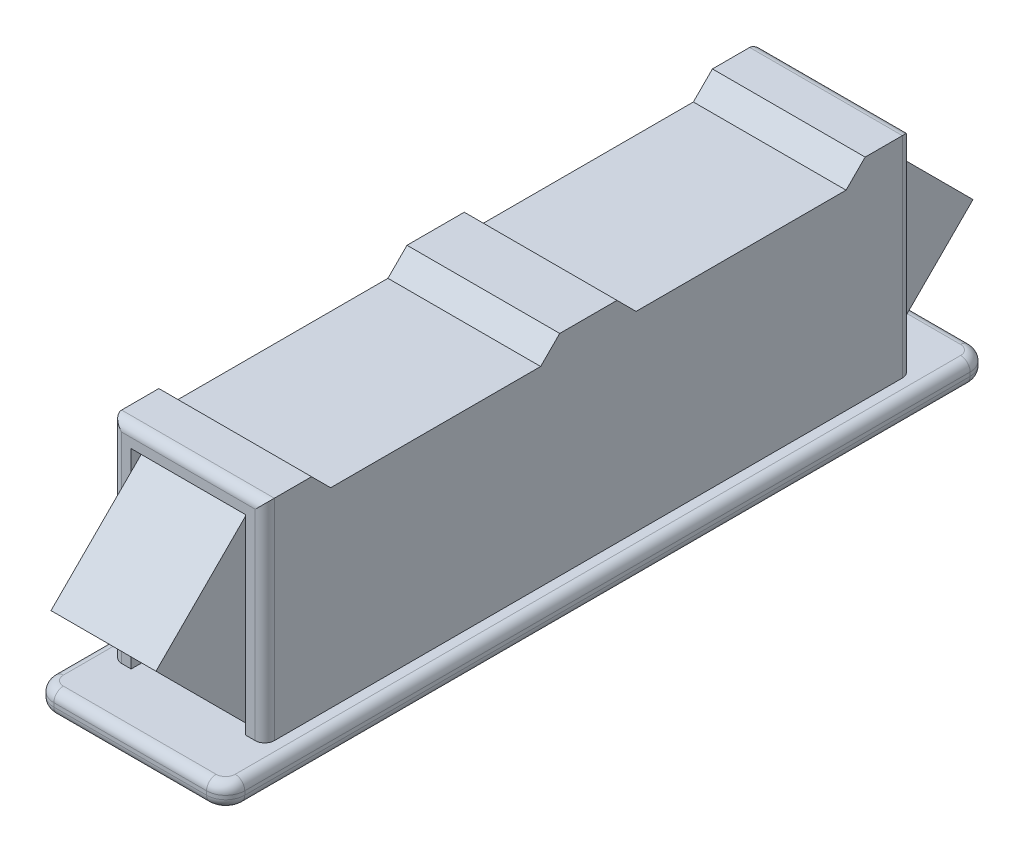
SolidWorks part; units mm, degrees
ref_plane "Front Plane" through (0, 0, 0) normal (0, 0, 1) x (1, 0, 0)
ref_plane "Top Plane" through (0, 0, 0) normal (0, 1, 0) x (1, 0, 0)
ref_plane "Right Plane" through (0, 0, 0) normal (1, 0, 0) x (0, 0, -1)
sketch "Sketch1" plane through (0, 0, 0) normal (0, 1, 0) x (1, 0, 0)
  line L1 (5, -20) -> (-5, -20)
  line L2 (5, -20) -> (5, 20)
  line L3 (5, 20) -> (-5, 20)
  line L4 (-5, -20) -> (-5, 20)
  line L5 (5, -20) -> (-5, 20) construction
  line L6 (5, 20) -> (-5, -20) construction
  point P0 (0, 0)
  dimension "D1" = 40
  dimension "D2" = 10
extrude "Boss-Extrude1" add sketch "Sketch1" against normal blind 1.2
sketch "Sketch2" plane through (0, -1.2, 0) normal (0, -1, 0) x (1, 0, 0)
  line L1 (4, 16.95) -> (-4, 16.95)
  line L2 (4, 16.95) -> (4, -16.95)
  line L3 (4, -16.95) -> (-4, -16.95)
  line L4 (-4, 16.95) -> (-4, -16.95)
  line L5 (4, 16.95) -> (-4, -16.95) construction
  line L6 (4, -16.95) -> (-4, 16.95) construction
  point P0 (0, 0)
  dimension "D1" = 8
  dimension "D2" = 33.9
extrude "Boss-Extrude2" add sketch "Sketch2" against normal blind 12.2
sketch "Sketch4" plane through (0, 0, 0) normal (0, 1, 0) x (1, 0, 0)
  line L0 (-8.6721, 0) -> (10.9166, 0) construction
sketch "Sketch6" plane through (0, -1.2, 0) normal (0, -1, 0) x (1, 0, 0)
  line L0 (0, -33.7192) -> (0, 34.4333) construction
sketch "Sketch7" plane through (0, -1.2, 0) normal (0, -1, 0) x (1, 0, 0)
  line L0 (0, -33.7192) -> (0, 34.4333) construction
  line L1 (-3.25, 1.5) -> (-1.75, 1.5)
  line L2 (-3.25, 1.5) -> (-3.25, 10.8)
  line L3 (-3.25, 10.8) -> (-1.75, 10.8)
  line L4 (-1.75, 1.5) -> (-1.75, 10.8)
  line L5 (-3.25, 1.5) -> (-1.75, 10.8) construction
  line L6 (-3.25, 10.8) -> (-1.75, 1.5) construction
  point P0 (-2.5, 6.15)
  point P5 (-2.5, 10.8)
  dimension "D1" = 1.5
  dimension "D2" = 9.3
  dimension "D3" = 2.5
  dimension "D4" = 1.5
extrude "Cut-Extrude1" cut sketch "Sketch7" against normal blind 0.5
mirror "Mirror1" about plane through (0, 0, 0) normal (1, 0, 0) of "Cut-Extrude1"
mirror "Mirror2" about plane through (0, 0, 0) normal (0, 0, 1) of "Mirror1", "Cut-Extrude1"
sketch "Sketch8" plane through (0, 0, 16.95) normal (0, 0, 1) x (1, 0, 0)
  line L0 (4, 11) -> (4, 0) construction
  line L1 (3, 0) -> (-3, 0)
  line L2 (3, 0) -> (3, 10)
  line L3 (3, 10) -> (-3, 10)
  line L4 (-3, 0) -> (-3, 10)
  line L5 (3, 0) -> (-3, 10) construction
  line L6 (3, 10) -> (-3, 0) construction
  line L7 (-4, 0) -> (4, 0) construction
  point P0 (0, 5)
  dimension "D1" = 10
  dimension "D2" = 6
  dimension "D3" = 4
extrude "Cut-Extrude2" cut sketch "Sketch8" against normal blind 1.5
mirror "Mirror3" about plane through (0, 0, 0) normal (0, 0, 1) of "Cut-Extrude2"
fillet "Fillet1" radius 1 4 edges at (-5, -0.6, -20) (5, -0.6, -20) (-5, -0.6, 20) (5, -0.6, 20)
fillet "Fillet2" radius 0.5 22 edges at (-4.7071, 0, 19.7071) (-5, 0, 0) (-4.7071, 0, -19.7071) (0, 0, -20) (4.7071, 0, -19.7071) (5, 0, 0) (4.7071, 0, 19.7071) (0, 0, 20) (4.7071, -1.2, 19.7071) (0, -1.2, 20) (-4.7071, -1.2, 19.7071) (-5, -1.2, 0) (-4.7071, -1.2, -19.7071) (0, -1.2, -20) (4.7071, -1.2, -19.7071) (-4, 5.5, -16.95) (0, 11, -16.95) (4, 5.5, -16.95) (-4, 5.5, 16.95) (0, 11, 16.95) (4, 5.5, 16.95) (5, -1.2, 0)
sketch "Sketch9" plane through (0, -0.7, 0) normal (0, -1, 0) x (1, 0, 0)
  line L0 (-1.75, 10.8) -> (-3.25, 10.8) construction
  line L1 (-1.75, 1.35) -> (-3.25, 1.35)
  line L2 (-1.75, 1.35) -> (-1.75, 10.8)
  line L3 (-1.75, 10.8) -> (-3.25, 10.8)
  line L4 (-3.25, 1.35) -> (-3.25, 10.8)
  line L5 (-1.75, 1.35) -> (-3.25, 10.8) construction
  line L6 (-1.75, 10.8) -> (-3.25, 1.35) construction
  line L7 (-1.75, 1.5) -> (-1.75, 10.8) construction
  line L8 (-4, 19.5) -> (4, 19.5) construction
  point P0 (-2.5, 6.075)
  dimension "D1" = 9.45
  dimension "D2" = 1.5
extrude "Boss-Extrude3" add sketch "Sketch9" along normal blind 1.8
fillet "Fillet3" radius 1 2 edges at (-2.5, -2.5, 1.35) (-2.5, -2.5, 10.8)
fillet "Fillet4" radius 0.2 10 edges at (-1.75, -1.35, 1.35) (-1.75, -2.2071, 1.6429) (-1.75, -1.35, 10.8) (-1.75, -2.2071, 10.5071) (-3.25, -1.35, 1.35) (-3.25, -1.35, 10.8) (-3.25, -2.2071, 10.5071) (-3.25, -2.5, 6.075) (-1.75, -2.5, 6.075) (-3.25, -2.2071, 1.6429)
mirror "Mirror4" about plane through (0, 0, 0) normal (1, 0, 0) of "Fillet4", "Fillet3", "Boss-Extrude3"
mirror "Mirror5" about plane through (0, 0, 0) normal (0, 0, 1) of "Mirror4", "Boss-Extrude3", "Fillet3", "Fillet4"
sketch "Sketch10" plane through (0, 0, 15.45) normal (0, 0, 1) x (1, 0, 0)
  line L1 (-2.75, 0.05) -> (2.75, 0.05)
  line L2 (-2.75, 0.05) -> (-2.75, 9.95)
  line L3 (-2.75, 9.95) -> (2.75, 9.95)
  line L4 (2.75, 0.05) -> (2.75, 9.95)
  line L5 (-2.75, 0.05) -> (2.75, 9.95) construction
  line L6 (-2.75, 9.95) -> (2.75, 0.05) construction
  line L10 (4, 11) -> (4, 0) construction
  line L11 (-3, 0) -> (3, 0) construction
  point P0 (0, 5)
  dimension "D1" = 5.5
  dimension "D2" = 4
  dimension "D3" = 9.9
  dimension "D4" = 5
extrude "Boss-Extrude5" add sketch "Sketch10" along normal blind 6
chamfer "Chamfer1" distance 5 angle 45 2 edges at (0, 0.05, 21.45) (0, 9.95, 21.45)
mirror "Mirror6" about plane through (0, 0, 0) normal (0, 0, 1) of "Chamfer1", "Boss-Extrude5"
sketch "Sketch11" plane through (0, 0, 0) normal (1, 0, 0) x (0, 0, -1)
  line L0 (0, 15.2342) -> (0, -8.3503) construction
sketch "Sketch14" plane through (0, 0, 0) normal (1, 0, 0) x (0, 0, -1)
  line L0 (-1.5, 11) -> (-14.5, 11)
  line L1 (16.45, 11) -> (-16.45, 11) construction
  line L2 (-14.5, 11) -> (-13.5, 10)
  line L3 (-13.5, 10) -> (-2.5, 10)
  line L4 (-2.5, 10) -> (-1.5, 11)
  line L5 (0, 15.2342) -> (0, -8.3503) construction
  dimension "D1" = 1.5
  dimension "D2" = 13
  dimension "D3" = 90
  dimension "D4" = 1
extrude "Cut-Extrude4" cut sketch "Sketch14" against normal mid plane 8
mirror "Mirror8" about plane through (0, 0, 0) normal (0, 0, 1) of "Cut-Extrude4"
